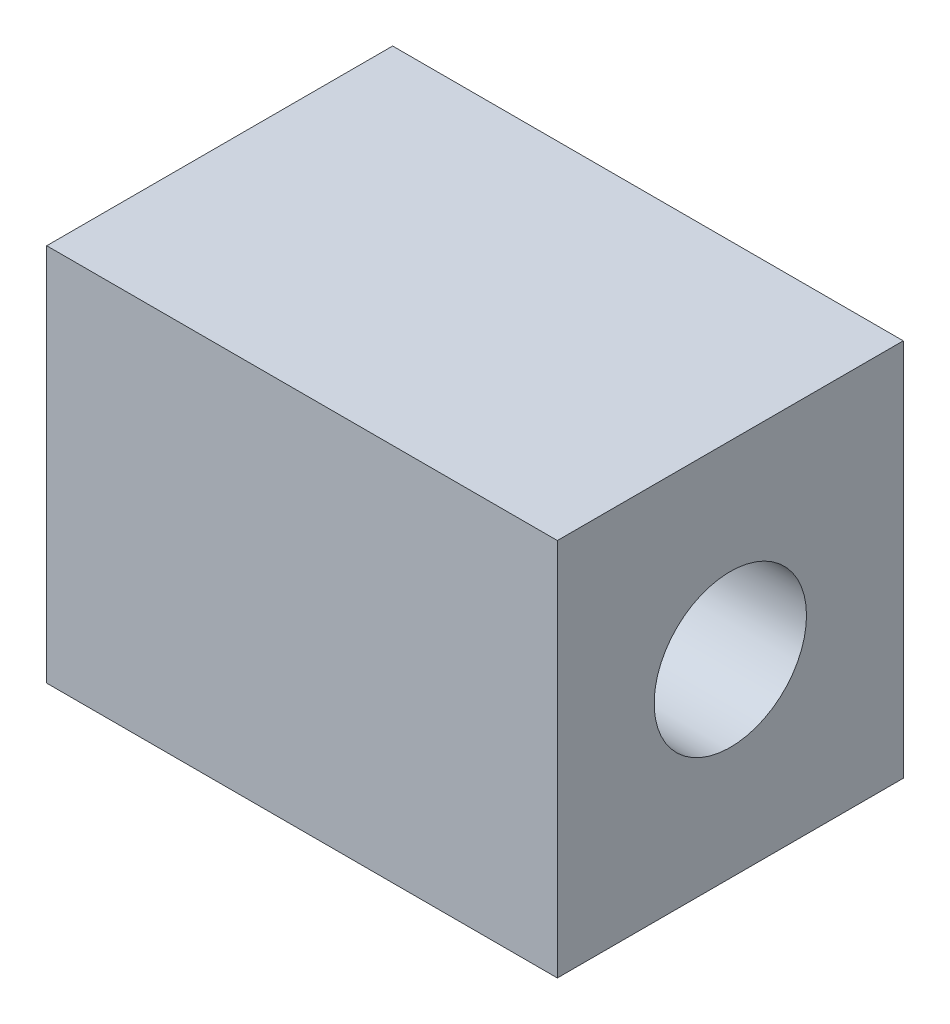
SolidWorks part; units mm, degrees
ref_plane "Plan de face" through (0, 0, 0) normal (0, 0, 1) x (1, 0, 0)
ref_plane "Plan de dessus" through (0, 0, 0) normal (0, 1, 0) x (1, 0, 0)
ref_plane "Plan de droite" through (0, 0, 0) normal (1, 0, 0) x (0, 0, -1)
sketch "Esquisse1" plane through (0, 0, 0) normal (0, 0, 1) x (1, 0, 0)
  line L1 (0, 0) -> (62, 0)
  line L2 (0, 0) -> (0, 46)
  line L3 (0, 46) -> (62, 46)
  line L4 (62, 0) -> (62, 46)
  dimension "D1" = 62
  dimension "D2" = 46
extrude "Extrusion1" add sketch "Esquisse1" along normal blind 42
hole_wizard "Trou taraudé M20x1.51" positions "Esquisse3" profile "Esquisse2" tap size "M20x1.5" standard "ISO"
sketch "Esquisse3" plane through (62, 0, 0) normal (1, 0, 0) x (0, 0, -1)
  line L0 (-42, 0) -> (-42, 46) construction
  line L1 (-42, 46) -> (0, 46) construction
  point P0 (-21, 23)
  dimension "D1" = 21
  dimension "D2" = 23
sketch "Esquisse2" plane through (62, 23, 21) normal (0, 1, 0) x (0, 0, -1)
  line L0 (0, 0) -> (0, 70.558)
  line L1 (0, 70.558) -> (9.25, 65)
  line L2 (9.25, 65) -> (9.25, 0)
  line L5 (9.25, 0) -> (0, 0)
  line L10 (0, 70.558) -> (-9.25, 65) construction
  line L11 (0, -6.35) -> (0, 107.95) construction
  dimension "Diamètre du trou pour taraudage" = 18.5
  dimension "Profondeur du trou pour taraudage" = 65
  dimension "Angle de pointe" = 118
